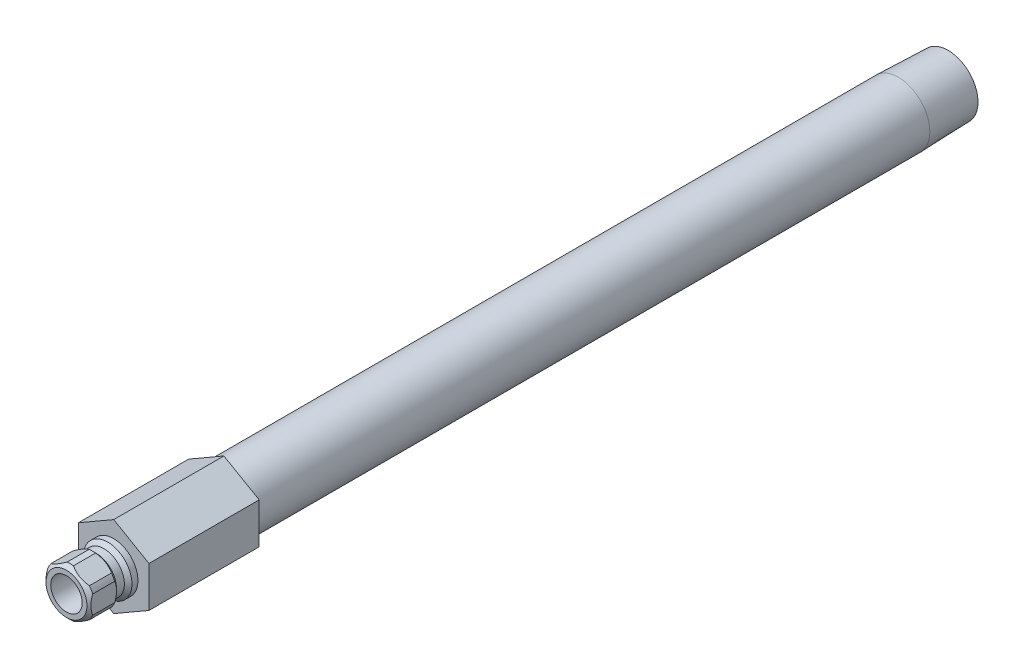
SolidWorks part; units mm, degrees
ref_plane "Front Plane" through (0, 0, 0) normal (0, 0, 1) x (1, 0, 0)
ref_plane "Top Plane" through (0, 0, 0) normal (0, 1, 0) x (1, 0, 0)
ref_plane "Right Plane" through (0, 0, 0) normal (1, 0, 0) x (0, 0, -1)
sketch "Sketch1" plane through (0, 0, 0) normal (1, 0, 0) x (0, 0, -1)
  line L0 (0, 0) -> (-12.7, 0) construction
  line L1 (-9.525, 3.175) -> (-9.525, 4.1275)
  line L2 (-3.556, 4.1275) -> (-3.556, 0) construction
  line L3 (-8.763, 4.8895) -> (-4.318, 4.8895)
  line L4 (0, 6.35) -> (0, 0) construction
  line L5 (-3.556, 4.1275) -> (-1.9685, 4.1275)
  line L6 (-1.2065, 4.8895) -> (0, 4.8895)
  line L7 (0, 4.8895) -> (0, 6.35)
  line L8 (-3.556, 4.1275) -> (-4.318, 4.8895)
  line L9 (-1.9685, 4.1275) -> (-1.2065, 4.8895)
  line L10 (-9.525, 4.1275) -> (-8.763, 4.8895)
  line L11 (22.225, 4.6228) -> (168.275, 4.6228)
  line L12 (0, 6.35) -> (158.242, 6.35)
  line L13 (158.242, 6.35) -> (168.275, 6.0365)
  line L14 (168.275, 6.0365) -> (168.275, 4.6228)
  line L15 (0, 0) -> (22.225, 0) construction
  line L16 (22.225, 0) -> (22.225, 4.8895) construction
  line L17 (22.225, 4.8895) -> (0, 4.8895) construction
  line L18 (22.225, 4.6228) -> (22.225, 3.175)
  line L19 (22.225, 3.175) -> (-9.525, 3.175)
  dimension "D1" = 9.525
  dimension "D2" = 1.5875
  dimension "D3" = 0.762
  dimension "D4" = 45
  dimension "D5" = 5.969
  dimension "D6" = 45
  dimension "D7" = 1.79
  dimension "D8" = 10.033
  dimension "D9" = 177.8
  dimension "D10" = 3.175
  dimension "D11" = 31.75
  dimension "D12" = 9.2456
  dimension "D13" = 6.35
  dimension "D14" = 9.779
  dimension "D15" = 12.7
revolve "Revolve1" add sketch "Sketch1" angle 360 about L0
sketch "Sketch2" plane through (0, 0, 0) normal (0, 0, 1) x (1, 0, 0)
  line L1 (-7.112, 4.1061) -> (-7.112, -4.1061)
  line L2 (-7.112, -4.1061) -> (0, -8.2122)
  line L3 (0, -8.2122) -> (7.112, -4.1061)
  line L4 (7.112, -4.1061) -> (7.112, 4.1061)
  line L5 (7.112, 4.1061) -> (0, 8.2122)
  line L6 (0, 8.2122) -> (-7.112, 4.1061)
  circle A0 centre (0, 0) radius 7.112 construction
  circle A1 centre (0, 0) radius 3.175 construction
  circle A2 centre (0, 0) radius 3.175
  dimension "D1" = 14.224
extrude "Boss-Extrude1" add sketch "Sketch2" against normal up to vertex (22.225 mm away) from vertex at 0
sketch "Sketch3" plane through (0, 0, 0) normal (0, 0, 1) x (1, 0, 0)
  line L1 (4.5212, -2.6103) -> (4.5212, 2.6103)
  line L2 (4.5212, 2.6103) -> (0, 5.2206)
  line L3 (0, 5.2206) -> (-4.5212, 2.6103)
  line L4 (-4.5212, 2.6103) -> (-4.5212, -2.6103)
  line L5 (-4.5212, -2.6103) -> (0, -5.2206)
  line L6 (0, -5.2206) -> (4.5212, -2.6103)
  circle A0 centre (0, 0) radius 4.5212 construction
  dimension "D1" = 9.0424
extrude "Cut-Extrude1" cut sketch "Sketch3" along normal through all from vertex at 3.556 flip side to cut
